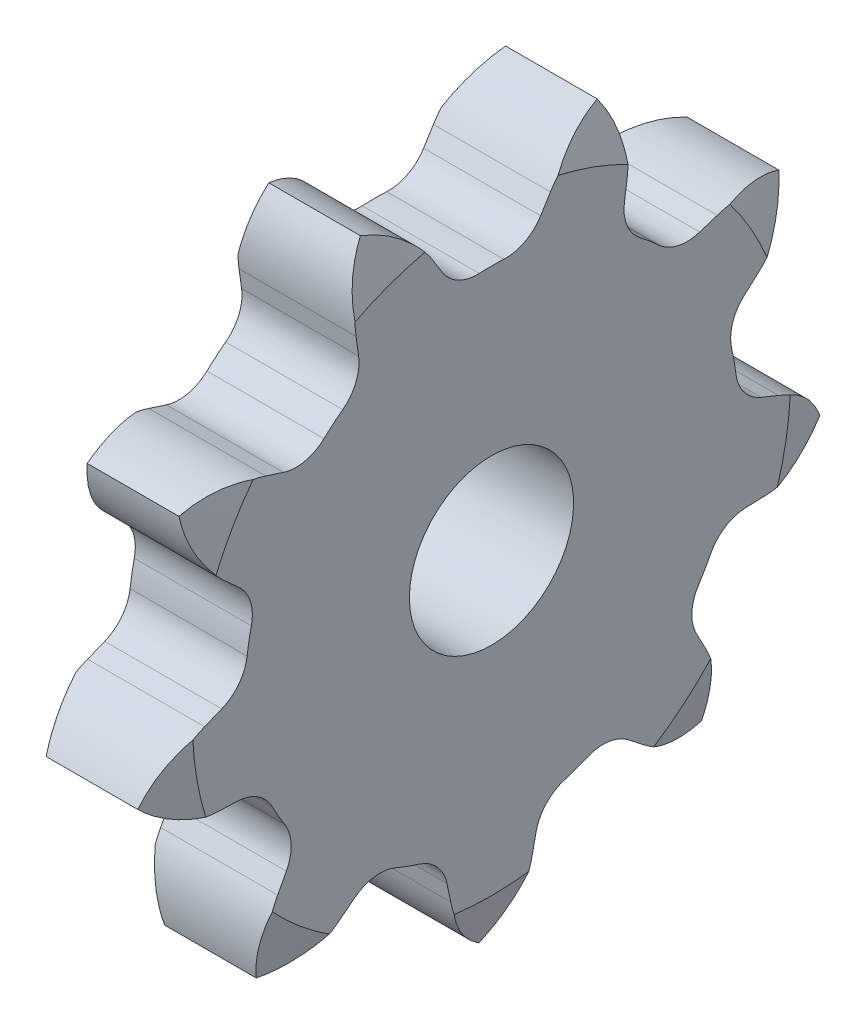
SolidWorks part; units mm, degrees
ref_plane "Plane1" through (0, 0, 0) normal (0, 0, 1) x (1, 0, 0)
ref_plane "Plane2" through (0, 0, 0) normal (0, 1, 0) x (1, 0, 0)
ref_plane "Plane3" through (0, 0, 0) normal (1, 0, 0) x (0, 0, -1)
sketch "Clipboard" plane through (0, 0, 0) normal (0, 1, 0) x (1, 0, 0)
  line L0 (0, 0) -> (62.7182, -9.9336)
  line L1 (-15, 0) -> (100, 0) construction
  line L2 (0, 0) -> (-2.1039, 2.3779)
  line L3 (0, 0) -> (-11.863, 4.5341)
  line L4 (0, 0) -> (8.5297, 1.351)
  line L5 (0, 0) -> (-71.3958, -26.6285)
  line L6 (0, 0) -> (-30.0043, -20.244)
  line L7 (-2.1039, 2.3779) -> (14.2981, 76.7917)
  line L8 (-76.2, 54.61) -> (-19.7358, 54.61)
  line L9 (-66.6514, 23.5599) -> (-51.1233, 26.8605)
  line L10 (-76.2, 71.12) -> (16.6308, 71.12)
  line L11 (0, 0) -> (-38.1, 0)
  line L12 (-76.2, 101.6) -> (-31.75, 101.6)
  circle A0 centre (0, 0) radius 15.875
  circle A1 centre (0, 0) radius 25.4
  circle A2 centre (0, 0) radius 25.4
  dimension "MHD" = 50.8
  dimension "Hub_dia" = 50.8
  dimension "Diameter" = 31.75
  dimension "Num_teeth" = 9
  dimension "Pitch_radius" = 92.8308
  dimension "Pitch" = 63.5
  dimension "Width" = 38.1
  dimension "Overall_len" = 76.2
  dimension "Show_teeth" = 9
  dimension "Thickness" = 36.195
  dimension "OAL" = 76.2001
  dimension "T_dim" = 56.4642
  dimension "Ap" = 12
  dimension "H" = 15.875
  dimension "F" = 44.45
sketch "BasProSke" plane through (0, 0, 0) normal (0, 1, 0) x (1, 0, 0)
  line L0 (-10, 0) -> (60, 0) construction
  line L1 (0, 0) -> (0, 92.496)
  line L2 (0, 0) -> (36.195, 0)
  line L3 (36.195, 0) -> (36.195, 92.496)
  line L4 (31.8516, 108.7058) -> (4.3434, 108.7058)
  line L5 (0, 92.496) -> (4.3434, 108.7058)
  line L6 (36.195, 92.496) -> (31.8516, 108.7058)
  dimension "D2" = 15
  dimension "D1" = 15
  dimension "G1" = 4.3434
  dimension "G2" = 4.3434
  dimension "Diameter" = 217.4116
  dimension "Thickness" = 36.195
revolve "Base-Revolve" add sketch "BasProSke" angle 360 about L0
sketch "TooCutSke" plane through (0, 0, 0) normal (1, 0, 0) x (0, 0, -1)
  line L0 (-15.1941, 82.0537) -> (-18.2226, 86.9003)
  line L1 (0, 0) -> (0, 107) construction
  line L2 (3.175, 0) -> (3.175, 119.782) construction
  line L3 (15.1941, 82.0537) -> (18.2226, 86.9003)
  line L4 (36.6386, 100.6637) -> (40.9823, 112.5978)
  line L5 (3.175, 96.303) -> (55.3039, 63.7293) construction
  line L6 (-36.6386, 100.6637) -> (-40.9823, 112.5978)
  arc A0 (3.7919, 76.0994) -> (-3.7919, 76.0994) centre (0, 0) ccw
  arc A1 (3.7919, 76.0994) -> (15.1941, 82.0537) centre (4.4239, 88.7836) ccw
  arc A2 (-3.7919, 76.0994) -> (-15.1941, 82.0537) centre (-4.4239, 88.7836) cw
  circle A3 centre (0, 0) radius 92.8308 construction
  circle A4 centre (3.175, 92.7765) radius 15.875 construction
  arc A5 (18.2226, 86.9003) -> (36.6386, 100.6637) centre (45.1481, 70.0753) cw
  arc A6 (-18.2226, 86.9003) -> (-36.6386, 100.6637) centre (-45.1481, 70.0753) ccw
  arc A7 (40.9823, 112.5978) -> (-40.9823, 112.5978) centre (0, 0) ccw
  dimension "D1" = 12.7
  dimension "R" = 12.7
  dimension "Dr" = 76.1938
  dimension "H" = 15.875
  dimension "Pitch_radius" = 92.8308
  dimension "Rt" = 31.75
  dimension "Ag" = 64
  dimension "Cp" = 3.175
  dimension "Wf" = 5.715
  dimension "Angle" = 40
extrude "ToothCut" cut sketch "TooCutSke" along normal through all
pattern_circular "TeethCuts" count 9 every 40 about axis through (-10, 0, 0) along (1, 0, 0) of "ToothCut"
sketch "HubNeaOneSke" plane through (0, 0, 0) normal (-1, 0, 0) x (0, 0, 1)
  circle A0 centre (0, 0) radius 25.4
  dimension "Diameter" = 50.8
extrude "HubNearOne" [suppressed] add sketch "HubNeaOneSke" along normal blind 40.0051
sketch "HubNeaBotSke" plane through (0, 0, 0) normal (-1, 0, 0) x (0, 0, 1)
  circle A0 centre (0, 0) radius 25.4
  dimension "Diameter" = 50.8
extrude "HubNearBoth" [suppressed] add sketch "HubNeaBotSke" along normal blind 20.0025
ref_plane "FarPln" through (36.195, 0, 0) normal (1, 0, 0) x (0, 0, -1)
sketch "HubFarSke" plane through (36.195, 0, 0) normal (1, 0, 0) x (0, 0, -1)
  circle A0 centre (0, 0) radius 25.4
  dimension "Diameter" = 50.8
extrude "HubFar" [suppressed] add sketch "HubFarSke" along normal blind 20.0025
sketch "BorSke" plane through (0, 0, 0) normal (1, 0, 0) x (0, 0, -1)
  circle A0 centre (0, 0) radius 25.4
  dimension "Diameter" = 50.8
extrude "Bore" cut sketch "BorSke" along normal mid plane 152.4001
sketch "KeySke" plane through (0, 0, 0) normal (1, 0, 0) x (0, 0, -1)
  line L0 (-6.35, 0) -> (-6.35, 31.0642)
  line L1 (-6.35, 31.0642) -> (6.35, 31.0642)
  line L2 (6.35, 31.0642) -> (6.35, 0)
  line L3 (0, 0) -> (0, 34) construction
  line L4 (-6.35, 0) -> (6.35, 0)
  dimension "Offset" = 31.0642
  dimension "Width" = 12.7
extrude "Keyway" [suppressed] cut sketch "KeySke" along normal mid plane 152.4001
pattern_circular "Keyway2" [suppressed] count 2 every 90 about axis through (-10, 0, 0) along (1, 0, 0)
equation "\"Thickness@Clipboard\" = \"Width@Clipboard\" * 0.95"
equation "\"H@Clipboard\" = \"Diameter@Clipboard\" / 2.0"
equation "\"OAL@Clipboard\" = \"Thickness@Clipboard\""
equation "\"Pitch_radius@Clipboard\" = ( \"Pitch@Clipboard\" / 2.0) / sin(3.14159265 / \"Num_teeth@Clipboard\" )"
equation "\"MHD@Clipboard\" = (1.0 / tan(3.14159265 / \"Num_teeth@Clipboard\" ) - 0.05) * \"Pitch@Clipboard\" - \"F@Clipboard\""
equation "\"MHD@Clipboard\" = ((sgn( \"MHD@Clipboard\" - \"Hub_dia@Clipboard\" )-1)*( \"MHD@Clipboard\" - \"Hub_dia@Clipboard\" ))/-2+ \"Hub_dia@Clipboard\""
equation "\"OAL@Clipboard\" = ((sgn( \"OAL@Clipboard\" - \"Overall_len@Clipboard\" )+1)*( \"OAL@Clipboard\" - \"Overall_len@Clipboard\" ))/2 + \"Overall_len@Clipboard\" + 0.000002"
equation "\"Num_teeth@TeethCuts\" = int( \"Show_teeth@Clipboard\" ) + 1"
equation "\"Num_teeth@TeethCuts\" = ((sgn( \"Num_teeth@TeethCuts\" - \"Num_teeth@Clipboard\" )-1)*( \"Num_teeth@TeethCuts\" - \"Num_teeth@Clipboard\" ))/-2+ \"Num_teeth@Clipboard\""
equation "\"Num_teeth@TeethCuts\" = ((sgn( \"Num_teeth@TeethCuts\" - 2.0)+1)*( \"Num_teeth@TeethCuts\" - 2.0))/2 +2.0"
equation "\"Angle@TeethCuts\" = 360.0 / \"Num_teeth@Clipboard\""
equation "\"Pitch_radius@TooCutSke\" = \"Pitch_radius@Clipboard\""
equation "\"Cp@TooCutSke\" = 0.05 * \"Pitch@Clipboard\""
equation "\"Rt@TooCutSke\" = 0.5 * \"Pitch@Clipboard\""
equation "\"R@TooCutSke\"  = 0.8 * \"H@Clipboard\""
equation "\"Dr@TooCutSke\" = \"Pitch_radius@Clipboard\" - \"H@Clipboard\" - 0.03"
equation "\"Ag@TooCutSke\" =  2.0 * \"Ap@Clipboard\" + 360.0 / \"Num_teeth@Clipboard\""
equation "\"H@TooCutSke\" = \"H@Clipboard\""
equation "\"Angle@TooCutSke\" =  360.0 / \"Num_teeth@Clipboard\""
equation "\"Wf@TooCutSke\" = 0.01 * \"Pitch@Clipboard\" * \"Num_teeth@Clipboard\""
equation "\"Wf@TooCutSke\" = ((sgn( \"Wf@TooCutSke\" - \"H@Clipboard\" * 0.8 )-1)*( \"Wf@TooCutSke\" - \"H@Clipboard\" * 0.8 ))/-2+ \"H@Clipboard\" * 0.8"
equation "\"Diameter@BasProSke\" = 2.0 * \"Pitch_radius@Clipboard\"  + 2.0 * \"H@Clipboard\""
equation "\"Thickness@BasProSke\"  = \"Thickness@Clipboard\""
equation "\"G1@BasProSke\" =  \"Thickness@Clipboard\" * 0.12"
equation "\"G2@BasProSke\" =   \"Thickness@Clipboard\" * 0.12"
equation "\"Diameter@HubNeaOneSke\" = \"MHD@Clipboard\""
equation "\"Length@HubNearOne\" = \"OAL@Clipboard\" - \"Thickness@BasProSke\""
equation "\"Diameter@HubNeaBotSke\" = \"MHD@Clipboard\""
equation "\"Length@HubNearBoth\" = ( \"OAL@Clipboard\" - \"Thickness@BasProSke\" ) / 2.0"
equation "\"Thickness@FarPln\" = \"Thickness@BasProSke\""
equation "\"Diameter@HubFarSke\" = \"MHD@Clipboard\""
equation "\"Length@HubFar\" = ( \"OAL@Clipboard\" - \"Thickness@BasProSke\" ) / 2.0"
equation "\"D1@Bore\" = \"OAL@Clipboard\" * 2.0"
equation "\"D1@Keyway\" = \"OAL@Clipboard\" * 2.0"
equation "\"Offset@KeySke\" = \"T_dim@Clipboard\" - \"Diameter@BorSke\" / 2.0"
